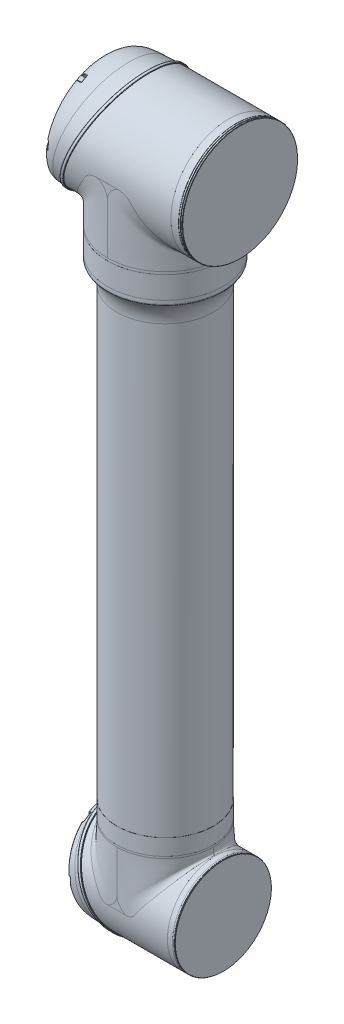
SolidWorks part; units mm, degrees
other "NONE"
ref_plane "前视基准面" through (0, 0, 0) normal (0, 0, 1) x (1, 0, 0)
ref_plane "上视基准面" through (0, 0, 0) normal (0, 1, 0) x (1, 0, 0)
ref_plane "右视基准面" through (0, 0, 0) normal (1, 0, 0) x (0, 0, -1)
imported_body "曲面-输入1"
imported_body "输入1"
imported_body "输入2"
imported_body "输入3"
imported_body "输入4"
imported_body "输入5"
imported_body "输入7"
imported_body "输入8"
imported_body "输入9"
imported_body "输入10"
imported_body "输入11"
imported_body "输入12"
imported_body "输入13"
imported_body "输入14"
imported_body "输入15"
imported_body "输入16"
imported_body "输入17"
imported_body "输入18"
imported_body "输入19"
imported_body "输入20"
imported_body "输入21"
imported_body "输入22"
imported_body "输入23"
imported_body "输入24"
imported_body "输入25"
imported_body "输入26"
delete or keep bodies "实体-删除/保留 1" type delete bodies bodies 106
